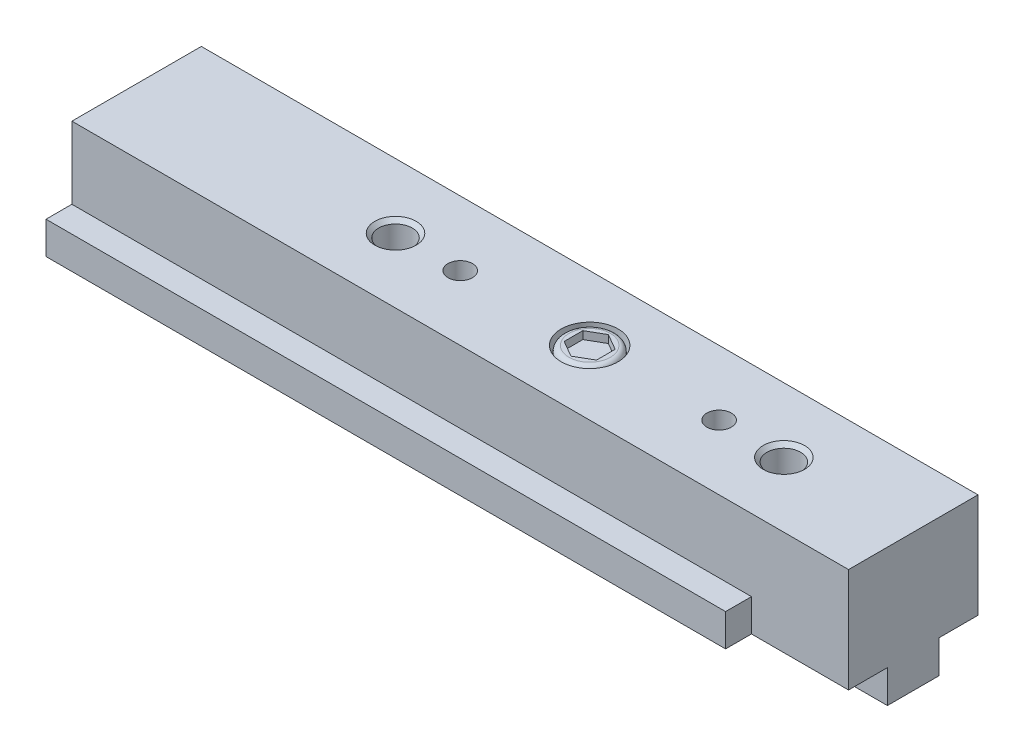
SolidWorks part; units mm, degrees
ref_plane "Front Plane" through (0, 0, 0) normal (0, 0, 1) x (1, 0, 0)
ref_plane "Top Plane" through (0, 0, 0) normal (0, 1, 0) x (1, 0, 0)
ref_plane "Right Plane" through (0, 0, 0) normal (1, 0, 0) x (0, 0, -1)
sketch "Sketch1" plane through (0, 0, 0) normal (1, 0, 0) x (0, 0, -1)
  line L0 (-8.89, 3.2258) -> (-2.54, 3.2258)
  line L1 (-2.54, 3.2258) -> (-2.54, 0)
  line L2 (-2.54, 0) -> (2.54, 0)
  line L3 (2.54, 0) -> (2.54, 3.2258)
  line L4 (2.54, 3.2258) -> (8.89, 3.2258)
  line L5 (8.89, 3.2258) -> (8.89, 6.4008)
  line L6 (8.89, 6.4008) -> (6.35, 6.4008)
  line L7 (6.35, 6.4008) -> (6.35, 13.462)
  line L8 (6.35, 13.462) -> (-6.35, 13.462)
  line L9 (-6.35, 13.462) -> (-6.35, 6.4008)
  line L10 (-6.35, 6.4008) -> (-8.89, 6.4008)
  line L11 (-8.89, 6.4008) -> (-8.89, 3.2258)
extrude "Extrude1" add sketch "Sketch1" along normal blind 66.675
ref_plane "Plane1" through (66.675, 0, 0) normal (1, 0, 0) x (0, 0, -1)
sketch "Sketch2" plane through (66.675, 0, 0) normal (1, 0, 0) x (0, 0, -1)
  line L0 (-6.35, 3.2258) -> (-2.54, 3.2258)
  line L1 (-2.54, 3.2258) -> (-2.54, 0)
  line L2 (-2.54, 0) -> (2.54, 0)
  line L3 (2.54, 0) -> (2.54, 3.2258)
  line L4 (2.54, 3.2258) -> (6.35, 3.2258)
  line L5 (6.35, 3.2258) -> (6.35, 13.462)
  line L6 (6.35, 13.462) -> (-6.35, 13.462)
  line L7 (-6.35, 13.462) -> (-6.35, 3.2258)
extrude "Extrude2" add sketch "Sketch2" along normal blind 9.525
ref_plane "Plane2" through (63.5, 0, 0) normal (1, 0, 0) x (0, 0, -1)
sketch "Sketch3" plane through (63.5, 0, 0) normal (1, 0, 0) x (0, 0, -1)
  line L0 (0, 13.462) -> (2.032, 13.462)
  line L1 (2.032, 13.462) -> (1.651, 13.081)
  line L2 (1.651, 13.081) -> (1.651, 6.1602)
  line L3 (1.651, 6.1602) -> (0, 5.207)
  line L4 (0, 5.207) -> (0, 13.462)
  line L5 (0, 5.207) -> (0, 13.462) construction
revolve "Cut-Revolve1" cut sketch "Sketch3" angle 360 about L5
ref_plane "Plane3" through (25.4, 0, 0) normal (1, 0, 0) x (0, 0, -1)
sketch "Sketch4" plane through (25.4, 0, 0) normal (1, 0, 0) x (0, 0, -1)
  line L0 (0, 13.462) -> (2.032, 13.462)
  line L1 (2.032, 13.462) -> (1.651, 13.081)
  line L2 (1.651, 13.081) -> (1.651, 8.0652)
  line L3 (1.651, 8.0652) -> (0, 7.112)
  line L4 (0, 7.112) -> (0, 13.462)
  line L5 (0, 7.112) -> (0, 13.462) construction
revolve "Cut-Revolve2" cut sketch "Sketch4" angle 360 about L5
ref_plane "Plane4" through (0, 13.462, 0) normal (0, 1, 0) x (-1, 0, 0)
sketch "Sketch5" plane through (0, 13.462, 0) normal (0, 1, 0) x (-1, 0, 0)
  circle A0 centre (-57.15, 0) radius 1.2027
extrude "Cut-Extrude1" cut sketch "Sketch5" against normal blind 3.048
sketch "Sketch6" plane through (0, 13.462, 0) normal (0, 1, 0) x (-1, 0, 0)
  circle A0 centre (-31.75, 0) radius 1.2027
extrude "Cut-Extrude2" cut sketch "Sketch6" against normal blind 3.048
sketch "Sketch7" plane through (0, 13.462, 0) normal (0, 1, 0) x (-1, 0, 0)
  circle A0 centre (-44.45, 0) radius 2.794
extrude "Cut-Extrude3" cut sketch "Sketch7" against normal blind 1.524
ref_plane "Plane5" through (44.45, 0, 0) normal (1, 0, 0) x (0, 0, -1)
sketch "Sketch8" plane through (44.45, 0, 0) normal (1, 0, 0) x (0, 0, -1)
  line L0 (0, 13.462) -> (2.032, 13.462)
  line L1 (2.54, 12.954) -> (2.54, 11.938)
  line L2 (2.54, 11.938) -> (0, 11.938)
  line L3 (0, 11.938) -> (0, 13.462)
  line L4 (0, 11.938) -> (0, 13.462) construction
  arc A0 (2.032, 13.462) -> (2.54, 12.954) centre (2.032, 12.954) cw
revolve "Revolve1" add sketch "Sketch8" angle 360 about L4
sketch "Sketch9" plane through (0, 13.462, 0) normal (0, 1, 0) x (-1, 0, 0)
  line L0 (-42.8625, -0.9165) -> (-42.8625, 0.9165)
  line L1 (-42.8625, 0.9165) -> (-44.45, 1.8331)
  line L2 (-44.45, 1.8331) -> (-46.0375, 0.9165)
  line L3 (-46.0375, 0.9165) -> (-46.0375, -0.9165)
  line L4 (-46.0375, -0.9165) -> (-44.45, -1.8331)
  line L5 (-44.45, -1.8331) -> (-42.8625, -0.9165)
extrude "Cut-Extrude4" cut sketch "Sketch9" against normal blind 0.762
ref_plane "Plane6" through (76.2, 0, 0) normal (1, 0, 0) x (0, 0, -1)
ref_plane "Plane7" through (49.1998, 0, 0) normal (1, 0, 0) x (0, 0, -1)
